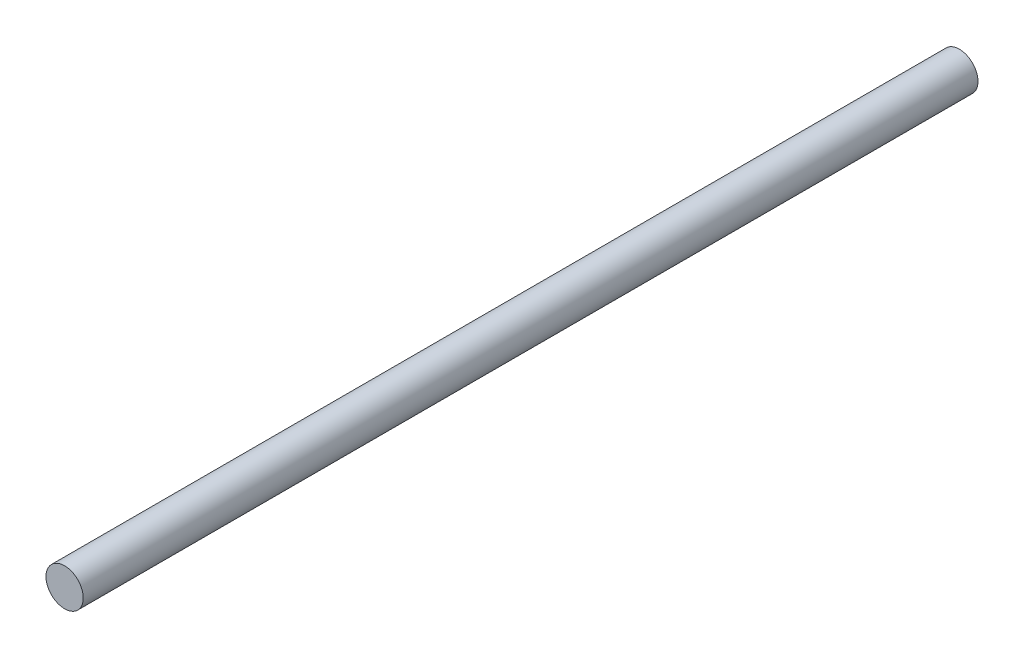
SolidWorks part; units mm, degrees
ref_plane "Plan de face" through (0, 0, 0) normal (0, 0, 1) x (1, 0, 0)
ref_plane "Plan de dessus" through (0, 0, 0) normal (0, 1, 0) x (1, 0, 0)
ref_plane "Plan de droite" through (0, 0, 0) normal (1, 0, 0) x (0, 0, -1)
sketch "Esquisse1" plane through (0, 0, 0) normal (0, 0, 1) x (1, 0, 0)
  circle A0 centre (0, 0) radius 10
  dimension "D1" = 20
extrude "Boss.-Extru.1" add sketch "Esquisse1" along normal blind 480
